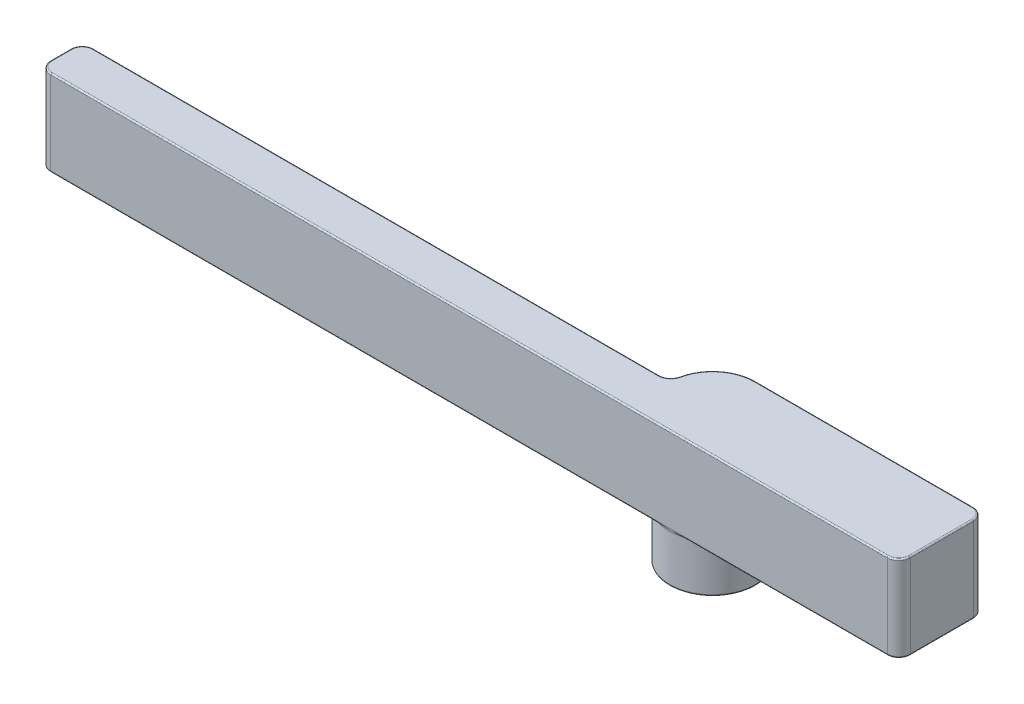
SolidWorks part; units mm, degrees
ref_plane "Plan de face" through (0, 0, 0) normal (0, 0, 1) x (1, 0, 0)
ref_plane "Plan de dessus" through (0, 0, 0) normal (0, 1, 0) x (1, 0, 0)
ref_plane "Plan de droite" through (0, 0, 0) normal (1, 0, 0) x (0, 0, -1)
sketch "Esquisse1" plane through (0, 0, 0) normal (0, 1, 0) x (1, 0, 0)
  line L1 (0, 0) -> (150, 0)
  line L2 (0, 0) -> (0, 15)
  line L3 (0, 15) -> (150, 15)
  line L4 (150, 0) -> (150, 15)
  dimension "D1" = 150
  dimension "D2" = 15
extrude "Boss.-Extru.1" add sketch "Esquisse1" along normal blind 15
sketch "Esquisse2" plane through (0, 0, 0) normal (0, -1, 0) x (1, 0, 0)
  line L0 (150, -15) -> (0, -15) construction
  line L1 (0, 0) -> (150, 0) construction
  line L2 (150, 0) -> (150, -15) construction
  circle A0 centre (110, -7.5) radius 7.5
  dimension "D1" = 40
extrude "Boss.-Extru.2" add sketch "Esquisse2" along normal blind 8.5
sketch "Esquisse3" plane through (0, -8.5, 0) normal (0, -1, 0) x (1, 0, 0)
  line L0 (107.9506, -5.9) -> (112.0494, -5.9)
  arc A0 (107.9506, -5.9) -> (112.0494, -5.9) centre (110, -7.5) ccw
  dimension "D1" = 5.2
  dimension "D2" = 4.2
extrude "Enlèv. mat.-Extru.1" cut sketch "Esquisse3" against normal blind 8
hole_wizard "Fraisage pour vis à tête fraisée M31" positions "Esquisse4" profile "Esquisse5" countersink size "M3" standard "ISO"
sketch "Esquisse4" plane through (0, 0, 0) normal (0, -1, 0) x (-1, 0, 0)
  line L0 (-150, 7.5) -> (-140, 7.5) construction
  line L1 (-150, 0) -> (-150, 15) construction
  point P0 (-140, 7.5)
  dimension "D1" = 10
sketch "Esquisse5" plane through (140, 0, -7.5) normal (1, 0, 0) x (0, 0, -1)
  line L0 (0, 0) -> (0, 13.0215)
  line L1 (0, 13.0215) -> (1.7, 12)
  line L2 (1.7, 12) -> (1.7, 1.45)
  line L3 (1.7, 1.45) -> (3.15, 0)
  line L5 (3.15, 0) -> (0, 0)
  line L6 (-1.7, 1.45) -> (-3.15, 0) construction
  line L10 (0, 13.0215) -> (-1.7, 12) construction
  line L11 (0, -6.35) -> (0, 107.95) construction
  dimension "Diamètre du perçage" = 3.4
  dimension "Profondeur du perçage" = 12
  dimension "Diamètre du fraisage entrant" = 6.3
  dimension "Angle du fraisage entrant" = 90
  dimension "Angle de pointe" = 118
sketch "Esquisse6" plane through (0, 15, 0) normal (0, 1, 0) x (1, 0, 0)
  line L0 (110, 15) -> (0, 15)
  line L1 (0, 15) -> (0, 7.5)
  line L2 (0, 15) -> (0, 0) construction
  line L3 (0, 7.5) -> (102.5, 7.5)
  arc A0 (110, 15) -> (102.5, 7.5) centre (110, 7.5) ccw
  arc A1 (110, 15) -> (110, 0) centre (110, 7.5) ccw construction
extrude "Enlèv. mat.-Extru.2" cut sketch "Esquisse6" against normal up to surface (15 mm away)
fillet "Congé1" radius 2 5 edges at (150, 7.5, 0) (150, 7.5, -15) (102.5, 7.5, -7.5) (0, 7.5, -7.5) (0, 7.5, 0)
sketch "Esquisse7" plane through (0, 0, -15) normal (0, 0, -1) x (-1, 0, 0)
  line L0 (-140, 13.0215) -> (-140, 0) construction
  line L1 (-142.9, 8.7) -> (-137.1, 8.7)
  line L2 (-142.9, 8.7) -> (-142.9, 6)
  line L3 (-142.9, 6) -> (-137.1, 6)
  line L4 (-137.1, 8.7) -> (-137.1, 6)
  line L5 (-148, 0) -> (-110, 0) construction
  dimension "D1" = 5.8
  dimension "D2" = 2.7
  dimension "D3" = 6
extrude "Enlèv. mat.-Extru.3" cut sketch "Esquisse7" against normal blind 7.5
sketch "Esquisse8" plane through (0, 6, 0) normal (0, 1, 0) x (1, 0, 0)
  line L0 (142.9, 7.5) -> (142.9, 15) construction
  line L1 (140, 10.8486) -> (137.1, 9.1743)
  line L2 (137.1, 9.1743) -> (137.1, 5.8257)
  line L3 (137.1, 5.8257) -> (140, 4.1514)
  line L4 (140, 4.1514) -> (142.9, 5.8257)
  line L5 (142.9, 5.8257) -> (142.9, 9.1743)
  line L6 (142.9, 9.1743) -> (140, 10.8486)
  circle A0 centre (140, 7.5) radius 2.9 construction
  arc A1 (141.7, 7.5) -> (138.3, 7.5) centre (140, 7.5) ccw construction
extrude "Enlèv. mat.-Extru.4" cut sketch "Esquisse8" along normal up to surface (2.7 mm away)
fillet "Congé2" radius 0.25 51 edges at (137.1, 7.35, -5.8257) (138.55, 6, -4.9885) (140, 7.35, -4.1514) (141.45, 6, -4.9885) (142.9, 7.35, -5.8257) (138.55, 8.7, -4.9885) (141.45, 8.7, -4.9885) (142.9, 7.35, -15) (140, 6, -15) (137.1, 7.35, -15) (140, 8.7, -15) (142.9, 6, -10.4128) (137.1, 6, -10.4128) (137.1, 8.7, -10.4128) (142.9, 8.7, -10.4128) (105.2879, 15, -13.3349) (51.3565, 15, -7.5) (51.3565, 0, -7.5) (140, 0, -10.65) (140, 1.45, -9.2) (140, 12, -9.2) (110, -8.5, -10.1) (110, -8.5, -5.9) (110, -0.5, -10.1) (110, -0.5, -5.9) (107.9506, -4.5, -5.9) (112.0494, -4.5, -5.9) (117.5, 0, -7.5) (110, -8.5, -15) (0, 0, -3.75) (129, 0, 0) (56, 0, 0) (150, 0, -7.5) (129, 0, -15) (0, 15, -3.75) (75, 15, 0) (150, 15, -7.5) (129, 15, -15) (104.1651, 0, -2.7879) (149.4142, 0, -14.4142) (149.4142, 0, -0.5858) (0.5858, 15, -0.5858) (0.5858, 15, -6.9142) (149.4142, 15, -14.4142) (149.4142, 15, -0.5858) (0.5858, 0, -0.5858) (0.5858, 0, -6.9142) (101.9695, 15, -7.944) (101.9695, 0, -7.944) (141.7, 6, -7.5) (140, 8.7, -5.8)
